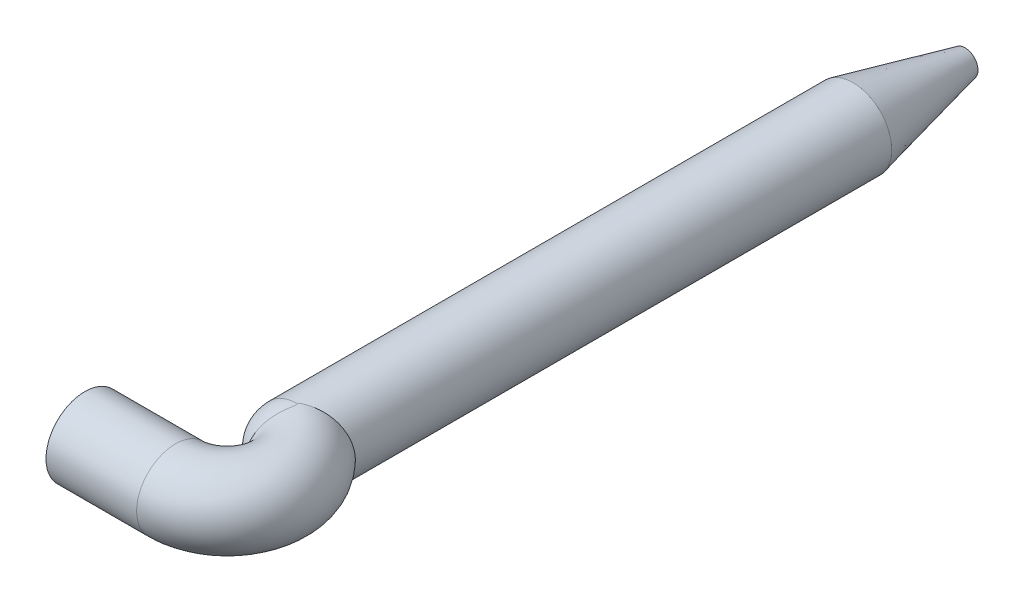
SolidWorks part; units mm, degrees
other "dirak_212-9712_d2iej04vlz8i2qitidpe4nzpu_3"
ref_plane "Plan de face" through (0, 0, 0) normal (0, 0, 1) x (1, 0, 0)
ref_plane "Plan de dessus" through (0, 0, 0) normal (0, 1, 0) x (1, 0, 0)
ref_plane "Plan de droite" through (0, 0, 0) normal (1, 0, 0) x (0, 0, -1)
imported_body "Importée1"
ref_plane "Plan1" through (0, 0, -11) normal (0, 0, 1) x (1, 0, 0)
sketch "Esquisse1" plane through (0, 0, -11) normal (0, 0, 1) x (1, 0, 0)
  circle A0 centre (2, -21.5) radius 3 construction
  circle A1 centre (2, -21.5) radius 3
extrude "Boss.-Extru.1" add sketch "Esquisse1" against normal blind 27
chamfer "Chanfrein1" distance 2 angle 77 1 edges at (5, -21.5, -38)
